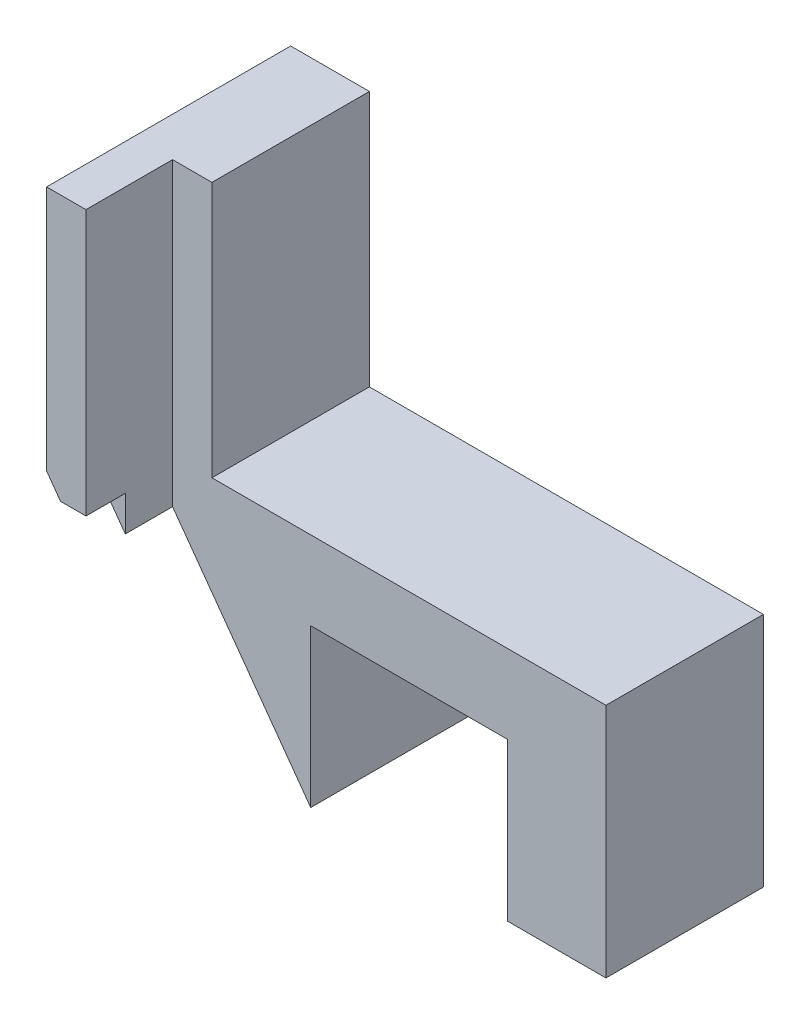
SolidWorks part; units mm, degrees
ref_plane "Front Plane" through (0, 0, 0) normal (0, 0, 1) x (1, 0, 0)
ref_plane "Top Plane" through (0, 0, 0) normal (0, 1, 0) x (1, 0, 0)
ref_plane "Right Plane" through (0, 0, 0) normal (1, 0, 0) x (0, 0, -1)
sketch "Sketch1" plane through (0, 0, 0) normal (0, 0, 1) x (1, 0, 0)
  line L0 (0, 0) -> (5, 0)
  line L1 (5, 0) -> (5, -4)
  line L2 (5, -4) -> (7.5, -4)
  line L3 (7.5, -4) -> (7.5, 2)
  line L4 (7.5, 2) -> (-2.5, 2)
  line L5 (-2.5, 2) -> (-2.5, -4)
  line L6 (-2.5, -4) -> (0, -4)
  line L7 (0, -4) -> (0, 0)
  dimension "D1" = 5
  dimension "D2" = 10
  dimension "D3" = 2
  dimension "D4" = 2.5
  dimension "D5" = 6
extrude "Extrude1" add sketch "Sketch1" along normal blind 4
sketch "Sketch2" plane through (0, 0, 0) normal (0, 0, -1) x (-1, 0, 0)
  line L0 (2.5, 2) -> (2.51, 2)
  line L1 (2.51, 2) -> (2.51, 8.5)
  line L2 (2.51, 8.5) -> (4.51, 8.5)
  line L3 (4.51, 8.5) -> (4.51, -4)
  line L4 (4.51, -4) -> (2.5, -4)
  line L5 (2.5, -4) -> (2.5, 2)
  line L6 (0, -4) -> (0, 0) construction
  dimension "D1" = 4.51
  dimension "D2" = 12.5
  dimension "D3" = 2
extrude "Extrude2" add sketch "Sketch2" against normal up to vertex (4 mm away)
sketch "Sketch3" plane through (0, 0, 4) normal (0, 0, 1) x (1, 0, 0)
  line L0 (-4.51, -4) -> (0, -4) construction
  line L1 (-4.51, 8.5) -> (-3.51, 8.5)
  line L2 (-4.51, 8.5) -> (-4.51, -4)
  line L3 (-4.51, -4) -> (-3.51, -4)
  line L4 (-3.51, 8.5) -> (-3.51, -4)
  dimension "D1" = 1
extrude "Extrude3" add sketch "Sketch3" along normal blind 2.2
sketch "Sketch4" plane through (0, 0, 6.2) normal (0, 0, 1) x (1, 0, 0)
  line L0 (-3.51, -4) -> (-3.51, 8.5) construction
  line L1 (-4.51, -4) -> (-3.51, -4)
  line L2 (-4.51, -4) -> (-4.51, 1.7585)
  line L3 (-4.51, 1.7585) -> (-3.51, 1.7585)
  line L4 (-3.51, -4) -> (-3.51, 1.7585)
extrude "Cut-Extrude1" cut sketch "Sketch4" against normal blind 1
sketch "Sketch5" plane through (0, 0, 0) normal (0, 0, -1) x (-1, 0, 0)
  line L0 (0, -4) -> (4.51, 2.25)
  line L1 (4.51, -4) -> (4.51, 8.5) construction
extrude "Extrude4" cut sketch "Sketch5" against normal through all and the other way through all flip side to cut
